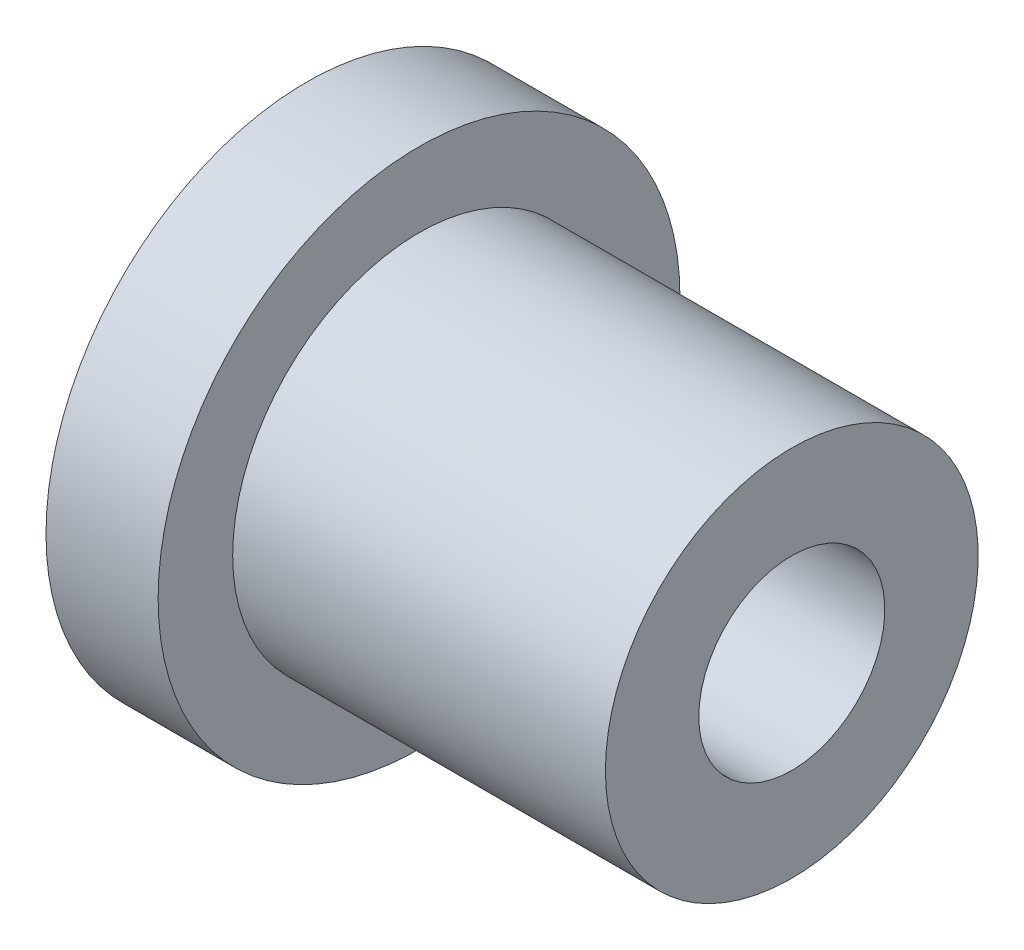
SolidWorks part; units mm, degrees
ref_plane "Front Plane" through (0, 0, 0) normal (0, 0, 1) x (1, 0, 0)
ref_plane "Top Plane" through (0, 0, 0) normal (0, 1, 0) x (1, 0, 0)
ref_plane "Right Plane" through (0, 0, 0) normal (1, 0, 0) x (0, 0, -1)
sketch "Sketch1" plane through (0, 0, 0) normal (0, 0, 1) x (1, 0, 0)
  line L0 (0, 0) -> (27.2769, 0) construction
  line L1 (0, 3.9624) -> (20.6502, 3.9624)
  line L2 (20.6502, 3.9624) -> (20.6502, 7.9375)
  line L3 (20.6502, 7.9375) -> (4.7752, 7.9375)
  line L4 (4.7752, 7.9375) -> (4.7752, 11.1125)
  line L5 (4.7752, 11.1125) -> (0, 11.1125)
  line L6 (0, 11.1125) -> (0, 3.9624)
  dimension "D1" = 7.9248
  dimension "D2" = 15.875
  dimension "D3" = 22.225
  dimension "D4" = 4.7752
  dimension "D5" = 15.875
revolve "Revolve1" add sketch "Sketch1" angle 360 about L0
